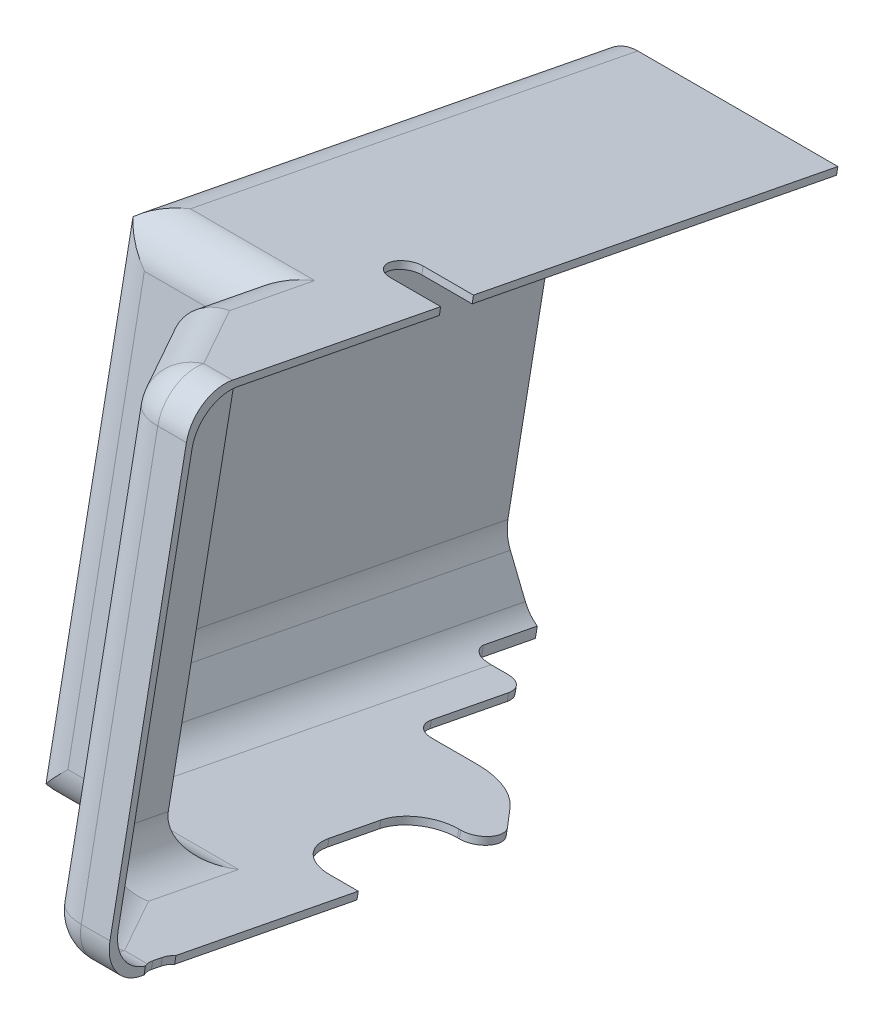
SolidWorks part; units mm, degrees
ref_plane "Front" through (0, 0, 0) normal (0, 0, 1) x (1, 0, 0)
ref_plane "Top" through (0, 0, 0) normal (0, 1, 0) x (1, 0, 0)
ref_plane "Right" through (0, 0, 0) normal (1, 0, 0) x (0, 0, -1)
imported_body "Imported1"
sketch "Sketch1" plane through (0, -111.2933, 21.6332) normal (0, 0.9816, -0.1908) x (-1, 0, 0)
  line L0 (834.1294, -321.3288) -> (874.1375, -321.3288) construction
  line L1 (834.1294, -533.4188) -> (864.8634, -533.4188)
  line L2 (834.1294, -533.4188) -> (834.1294, -321.3288)
  line L3 (834.1294, -321.3288) -> (864.8634, -321.3288)
  line L4 (864.8634, -533.4188) -> (864.8634, -321.3288)
  dimension "D1" = 30.734
extrude "Cut-Extrude1" cut sketch "Sketch1" against normal through all
